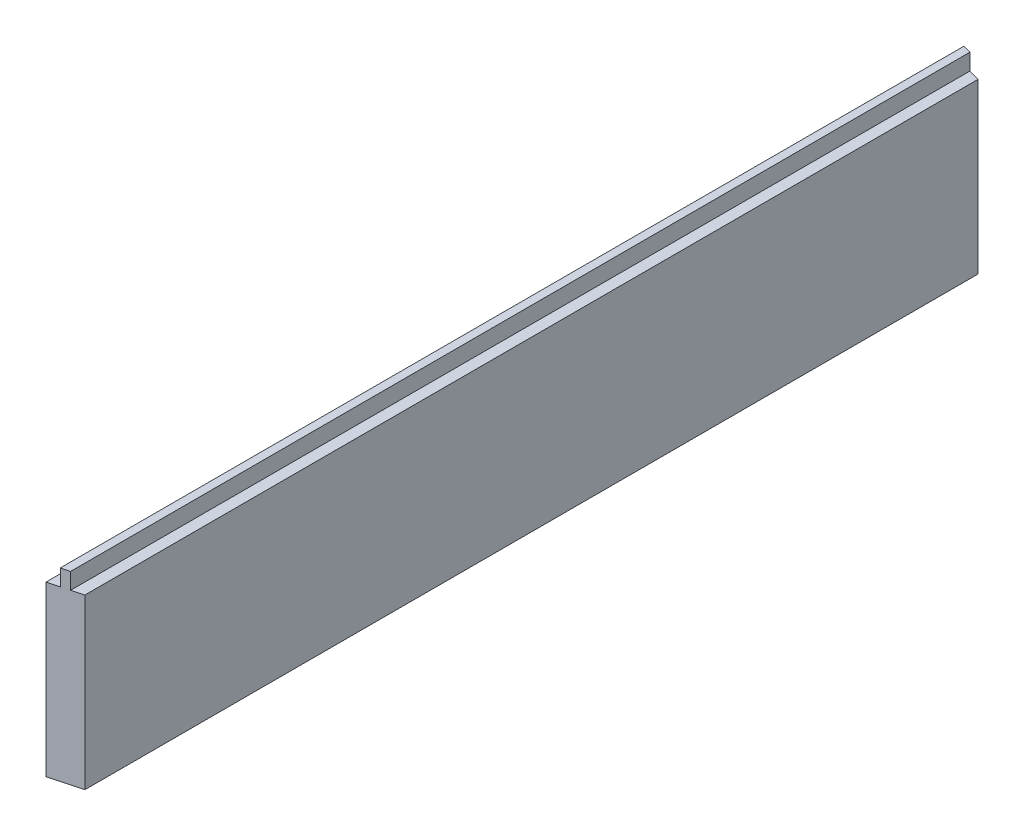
SolidWorks part; units mm, degrees
ref_plane "Plan de face" through (0, 0, 0) normal (0, 0, 1) x (1, 0, 0)
ref_plane "Plan de dessus" through (0, 0, 0) normal (0, 1, 0) x (1, 0, 0)
ref_plane "Plan de droite" through (0, 0, 0) normal (1, 0, 0) x (0, 0, -1)
sketch "Esquisse1" plane through (0, 0, 0) normal (0, 0, 1) x (1, 0, 0)
  line L1 (7.5, -41.25) -> (-7.5, -41.25)
  line L2 (7.5, -41.25) -> (7.5, 41.25)
  line L3 (7.5, 41.25) -> (-7.5, 41.25)
  line L4 (-7.5, -41.25) -> (-7.5, 41.25)
  line L5 (7.5, -41.25) -> (-7.5, 41.25) construction
  line L6 (7.5, 41.25) -> (-7.5, -41.25) construction
  line L7 (-2, -35.25) -> (2, -35.25)
  line L8 (-2, -35.25) -> (-2, -47.25)
  line L9 (-2, -47.25) -> (2, -47.25)
  line L10 (2, -35.25) -> (2, -47.25)
  line L11 (-2, -35.25) -> (2, -47.25) construction
  line L12 (-2, -47.25) -> (2, -35.25) construction
  line L13 (-2, 49.25) -> (2, 49.25)
  line L14 (-2, 49.25) -> (-2, 33.25)
  line L15 (-2, 33.25) -> (2, 33.25)
  line L16 (2, 49.25) -> (2, 33.25)
  line L17 (-2, 49.25) -> (2, 33.25) construction
  line L18 (-2, 33.25) -> (2, 49.25) construction
  point P0 (0, 0)
  point P5 (0, -41.25)
  point P11 (0, 41.25)
  dimension "D1" = 82.5
  dimension "D2" = 15
  dimension "D3" = 12
  dimension "D4" = 4
  dimension "D5" = 16
  dimension "D6" = 4
extrude "Boss.-Extru.1" add sketch "Esquisse1" along normal blind 445 contours L3 L16 L15 L14 L4 L1 L8 L7 L10 L2 | L16 L3 L14 L15 | L16 L13 L14 L3 | L10 L7 L8 L1
sketch "Esquisse2" plane through (0, 0, 0) normal (0, 1, 0) x (1, 0, 0)
  line L0 (-7.5, 0) -> (7.5, 0)
  line L1 (7.5, 0) -> (7.5, -4.0192)
  line L2 (7.5, -445) -> (7.5, 0) construction
  line L3 (7.5, -4.0192) -> (-7.5, 0)
  line L4 (-7.5, -445) -> (7.5, -445)
  line L5 (7.5, -445) -> (7.5, -440.9808)
  line L6 (7.5, -440.9808) -> (-7.5, -445)
  arc A0 (-3.067, 0) -> (-3.2181, -1.1473) centre (-7.5, 0) cw
  arc A1 (0, -445) -> (-0.2556, -443.0589) centre (-7.5, -445) ccw
extrude "Enlèv. mat.-Extru.1" cut sketch "Esquisse2" against normal through all both and the other way through all contours L6 L4 L5 | L0 L1 L3
